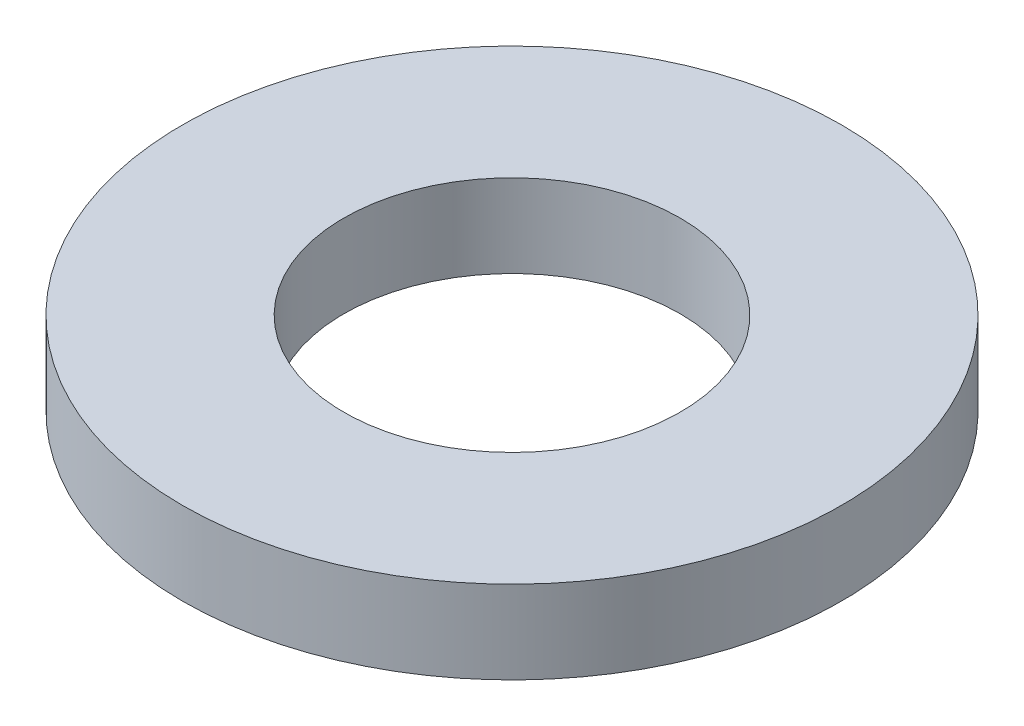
SolidWorks part; units mm, degrees
ref_plane "Front Plane" through (0, 0, 0) normal (0, 0, 1) x (1, 0, 0)
ref_plane "Top Plane" through (0, 0, 0) normal (0, 1, 0) x (1, 0, 0)
ref_plane "Right Plane" through (0, 0, 0) normal (1, 0, 0) x (0, 0, -1)
sketch "Sketch1" plane through (0, 0, 0) normal (0, 1, 0) x (1, 0, 0)
  circle A0 centre (0, 0) radius 9.7234
  circle A1 centre (0, 0) radius 19.05
  dimension "D1" = 19.4469
  dimension "D2" = 38.1
extrude "Boss-Extrude1" add sketch "Sketch1" along normal blind 4.7942
